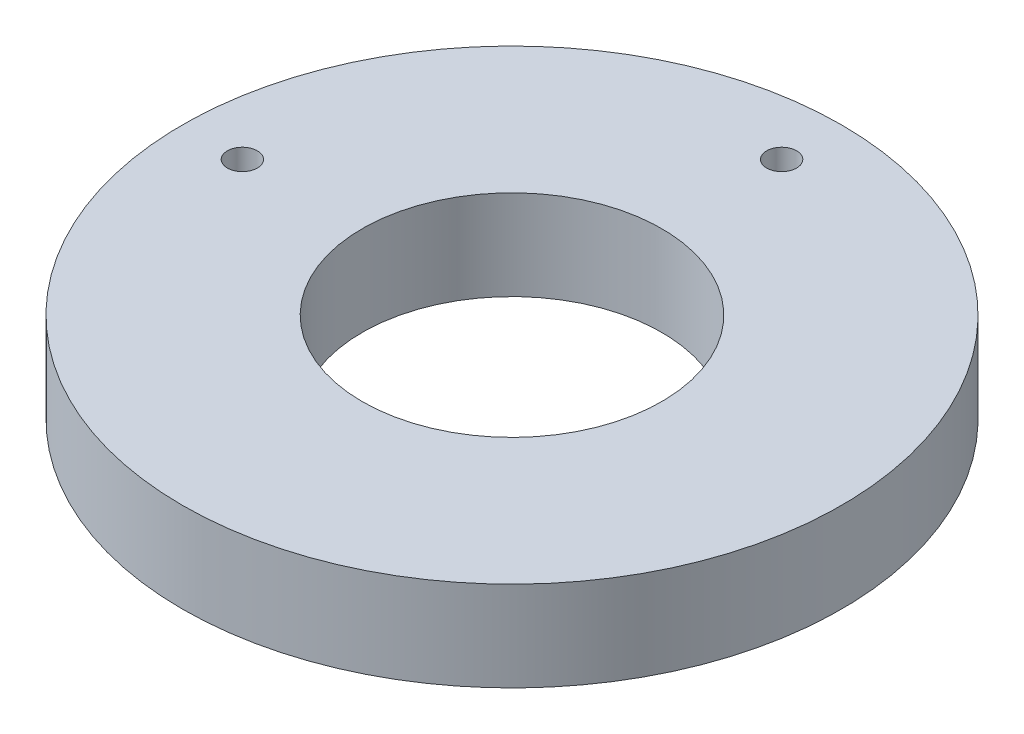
SolidWorks part; units mm, degrees
ref_plane "Front Plane" through (0, 0, 0) normal (0, 0, 1) x (1, 0, 0)
ref_plane "Top Plane" through (0, 0, 0) normal (0, 1, 0) x (1, 0, 0)
ref_plane "Right Plane" through (0, 0, 0) normal (1, 0, 0) x (0, 0, -1)
sketch "Sketch1" plane through (0, 0, 0) normal (0, 1, 0) x (1, 0, 0)
  circle A0 centre (0, 0) radius 11
  circle A1 centre (0, 0) radius 5
  dimension "D1" = 22
  dimension "D2" = 10
extrude "Boss-Extrude1" add sketch "Sketch1" along normal blind 3
sketch "Sketch2" plane through (0, 0, 0) normal (0, 1, 0) x (1, 0, 0)
  line L0 (0, 0) -> (0, 9) construction
  line L1 (0, 0) -> (-9, 0) construction
  circle A0 centre (0, 0) radius 9 construction
  circle A3 centre (-9, 0) radius 0.5
  circle A4 centre (0, 9) radius 0.5
  dimension "D1" = 18
  dimension "D3" = 1
  dimension "D2" = 1
extrude "Cut-Extrude1" cut sketch "Sketch2" along normal up to next
